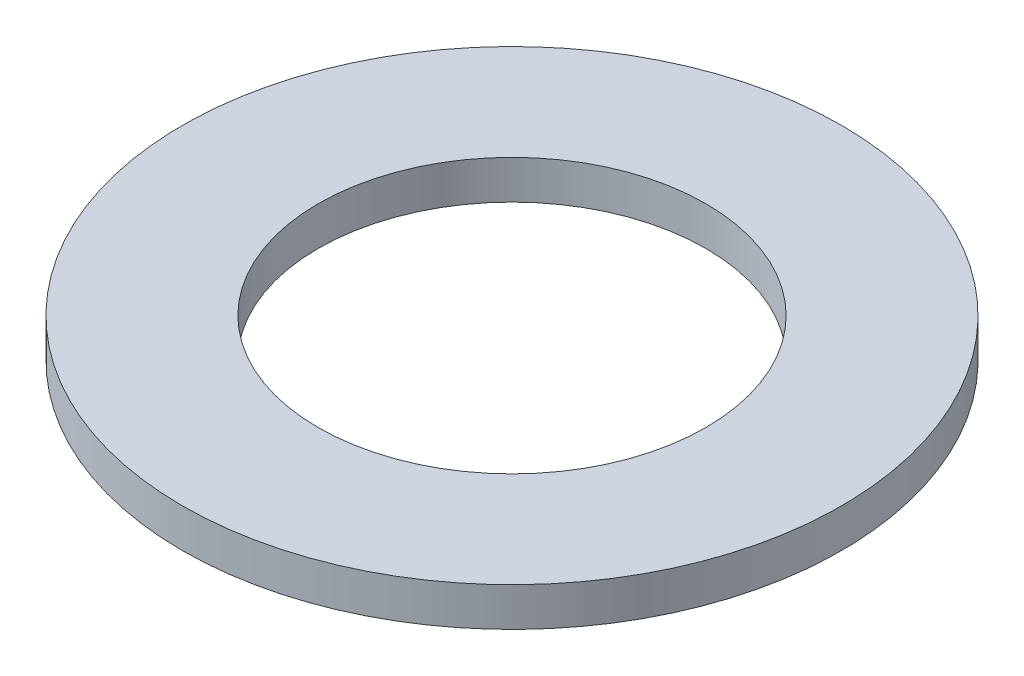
SolidWorks part; units mm, degrees
ref_plane "Plan de face" through (0, 0, 0) normal (0, 0, 1) x (1, 0, 0)
ref_plane "Plan de dessus" through (0, 0, 0) normal (0, 1, 0) x (1, 0, 0)
ref_plane "Plan de droite" through (0, 0, 0) normal (1, 0, 0) x (0, 0, -1)
sketch "Esquisse1" plane through (0, 0, 0) normal (0, 1, 0) x (1, 0, 0)
  circle A0 centre (0, 0) radius 5
  circle A1 centre (0, 0) radius 8.5
  dimension "D1" = 10
  dimension "D2" = 17
extrude "Extrusion1" add sketch "Esquisse1" along normal blind 1
